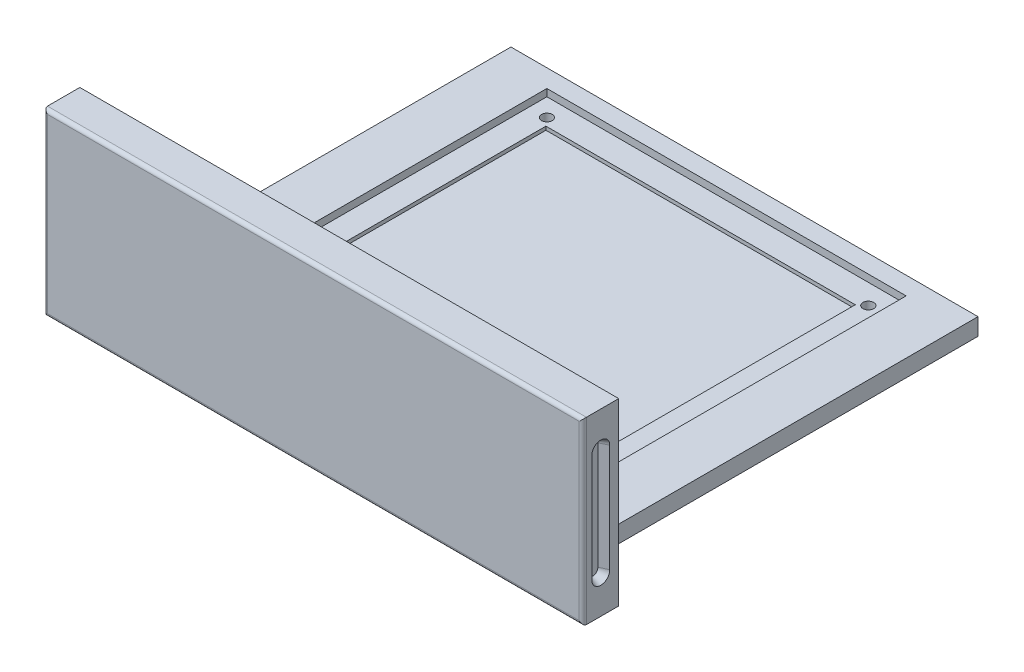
SolidWorks part; units mm, degrees
ref_plane "Front Plane" through (0, 0, 0) normal (0, 0, 1) x (1, 0, 0)
ref_plane "Top Plane" through (0, 0, 0) normal (0, 1, 0) x (1, 0, 0)
ref_plane "Right Plane" through (0, 0, 0) normal (1, 0, 0) x (0, 0, -1)
sketch "Sketch1" plane through (0, 0, 0) normal (0, 1, 0) x (1, 0, 0)
  line L1 (-65, -55) -> (65, -55)
  line L2 (-65, -55) -> (-65, 55)
  line L3 (-65, 55) -> (65, 55)
  line L4 (65, -55) -> (65, 55)
  line L5 (-65, -55) -> (65, 55) construction
  line L6 (-65, 55) -> (65, -55) construction
  point P0 (0, 0)
  dimension "D1" = 110
  dimension "D2" = 130
extrude "Boss-Extrude1" add sketch "Sketch1" along normal blind 4.75
sketch "Sketch2" plane through (0, 4.75, 0) normal (0, 1, 0) x (1, 0, 0)
  line L1 (-50, -50) -> (50, -50)
  line L2 (-50, -50) -> (-50, 50)
  line L3 (-50, 50) -> (50, 50)
  line L4 (50, -50) -> (50, 50)
  line L5 (-50, -50) -> (50, 50) construction
  line L6 (-50, 50) -> (50, -50) construction
  point P0 (0, 0)
  dimension "D1" = 100
  dimension "D2" = 100
extrude "Cut-Extrude1" cut sketch "Sketch2" against normal blind 2
sketch "Sketch3" plane through (0, 2.75, 0) normal (0, 1, 0) x (1, 0, 0)
  line L0 (-50, 50) -> (-50, -50) construction
  line L1 (50, -50) -> (50, 50) construction
  line L4 (-50, -50) -> (50, -50) construction
  line L6 (50, -50) -> (50, 50) construction
  line L8 (50, 50) -> (-50, 50) construction
  circle A0 centre (-45, 45) radius 1.5
  circle A1 centre (45.055, 44.414) radius 1.5
  circle A2 centre (-44.97, -44.586) radius 1.5
  circle A3 centre (45.005, -44.761) radius 1.5
  dimension "D1" = 3
  dimension "D2" = 5
  dimension "D3" = 5
  dimension "D4" = 5.586
  dimension "D5" = 4.945
  dimension "D6" = 5.239
  dimension "D7" = 4.995
  dimension "D8" = 5.414
  dimension "D9" = 5.03
extrude "Cut-Extrude2" cut sketch "Sketch3" against normal up to next
sketch "Sketch4" plane through (0, 0, 55) normal (0, 0, 1) x (1, 0, 0)
  line L0 (-65, 0) -> (65, 0) construction
  line L1 (-75, 45) -> (75, 45)
  line L2 (-75, 45) -> (-75, -5)
  line L3 (-75, -5) -> (75, -5)
  line L4 (75, 45) -> (75, -5)
  line L5 (65, 4.75) -> (65, 0) construction
  dimension "D1" = 150
  dimension "D2" = 50
  dimension "D3" = 5
  dimension "D4" = 10
extrude "Boss-Extrude2" add sketch "Sketch4" along normal blind 10
sketch "Sketch5" plane through (-75, 0, 0) normal (-1, 0, 0) x (0, 0, 1)
  line L0 (60, 5) -> (60, 35) construction
  line L1 (57.5, 5) -> (57.5, 35)
  line L2 (62.5, 5) -> (62.5, 35)
  line L3 (65, 45) -> (55, 45) construction
  line L4 (65, 45) -> (65, -5) construction
  arc A0 (57.5, 5) -> (62.5, 5) centre (60, 5) ccw
  arc A1 (62.5, 35) -> (57.5, 35) centre (60, 35) ccw
  point P2 (60, 20)
  point P9 (60, 45)
  point P12 (65, 20)
  dimension "D1" = 30
  dimension "D2" = 5
extrude "Cut-Extrude3" cut sketch "Sketch5" against normal blind 2.25 draft 25
mirror "Mirror1" about plane through (0, 0, 0) normal (1, 0, 0) of "Cut-Extrude3"
fillet "Fillet1" radius 1 4 edges at (75, 20, 65) (-75, 20, 65) (0, -5, 65) (0, 45, 65)
sketch "Sketch6" plane through (0, 2.75, 0) normal (0, 1, 0) x (1, 0, 0)
  line L1 (-43.0557, -42.7928) -> (43.0557, -42.7928)
  line L2 (-43.0557, -42.7928) -> (-43.0557, 42.7928)
  line L3 (-43.0557, 42.7928) -> (43.0557, 42.7928)
  line L4 (43.0557, -42.7928) -> (43.0557, 42.7928)
  line L5 (-43.0557, -42.7928) -> (43.0557, 42.7928) construction
  line L6 (-43.0557, 42.7928) -> (43.0557, -42.7928) construction
  point P0 (0, 0)
extrude "Cut-Extrude4" cut sketch "Sketch6" against normal blind 1
